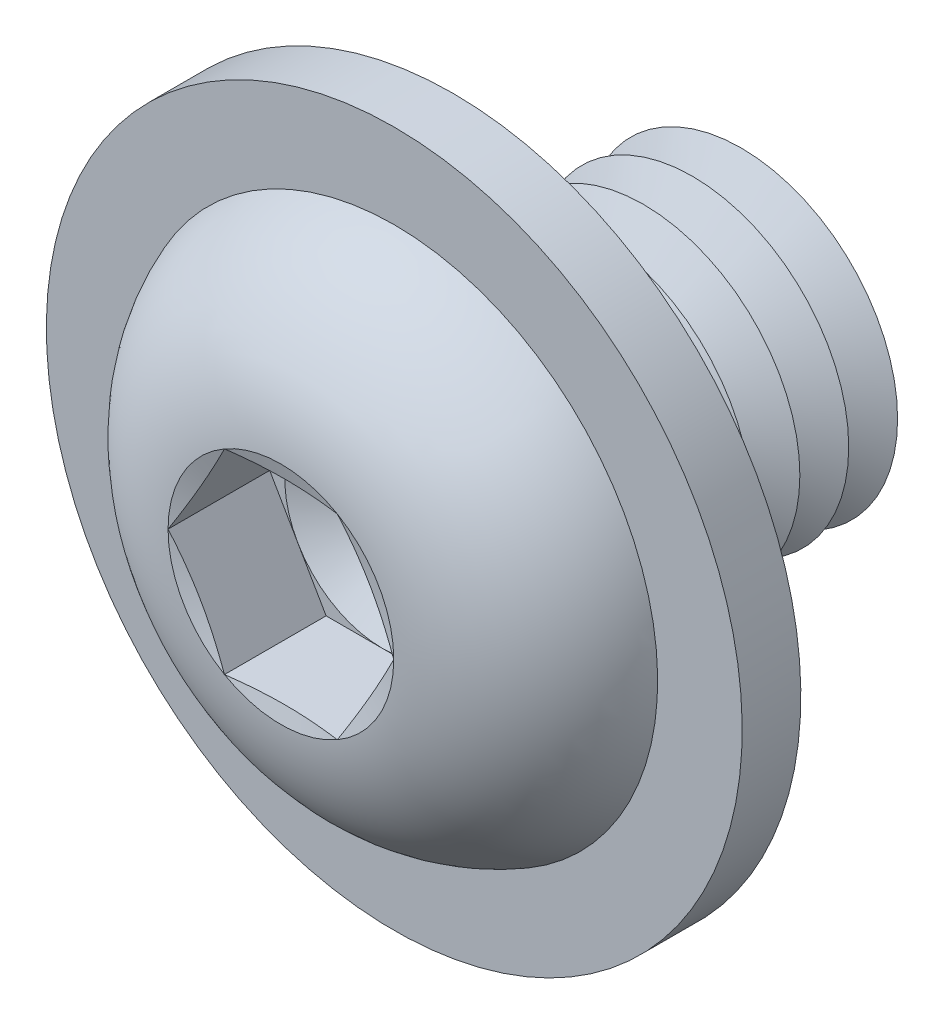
SolidWorks part; units mm, degrees
ref_plane "Front Plane" through (0, 0, 0) normal (0, 0, 1) x (1, 0, 0)
ref_plane "Top Plane" through (0, 0, 0) normal (0, 1, 0) x (1, 0, 0)
ref_plane "Right Plane" through (0, 0, 0) normal (1, 0, 0) x (0, 0, -1)
sketch "Sketch1" plane through (0, 0, 0) normal (1, 0, 0) x (0, 0, -1)
  line L0 (0, 4) -> (0, 7)
  line L3 (0, 4) -> (8, 4)
  line L4 (8, 4) -> (8, 0)
  line L5 (8, 0) -> (-4.4, 0) construction
  line L6 (-4.4, 0) -> (8, 0)
  line L7 (-4.4, 2.8867) -> (-4.4, 1.4434) construction
  line L8 (-4.4, 1.4434) -> (-4.4, 0)
  line L9 (-4.4, 2.8867) -> (-4.0132, 1.4434)
  line L10 (-4.0132, 1.4434) -> (-4.4, 1.4434)
  line L11 (8, 0) -> (22.7481, 0) construction
  line L12 (0, 7) -> (-4.4, 7) construction
  arc A1 (0, 7) -> (-4.4, 2.8867) centre (0, 2.59) ccw
  point P8 (8, 2)
  dimension "D1" = 14
  dimension "D2" = 8
  dimension "D3" = 4.4
  dimension "D4" = 5.7735
  dimension "D5" = 8
  dimension "D6" = 15
revolve "Revolve1" add sketch "Sketch1" angle 360 about L5
fillet "Fillet1" radius 0.625 1 edges at (0, 4, 0)
sketch "Sketch2" plane through (0, 0, 0) normal (1, 0, 0) x (0, 0, -1)
  line L0 (7.375, 4) -> (8.625, 4)
  line L1 (8, 4) -> (0.625, 4) construction
  line L2 (8.625, 4) -> (8, 2.9175)
  line L3 (8, -4) -> (8, 4) construction
  line L4 (8, 2.9175) -> (7.375, 4)
  dimension "D1" = 1.25
revolve "Cut-Revolve1" cut sketch "Sketch2" angle 360 about axis through (0, 0, -8) along (0, 0, -1)
pattern_linear "LPattern1" count 6 spacing 1.25 along (0, 0, 1) of "Cut-Revolve1"
sketch "Sketch3" plane through (0, 0, 4.4) normal (0, 0, 1) x (1, 0, 0)
  line L7 (1.4434, 2.5) -> (-1.4434, 2.5)
  line L8 (-1.4434, 2.5) -> (-2.8868, 0)
  line L9 (-2.8868, 0) -> (-1.4434, -2.5)
  line L10 (-1.4434, -2.5) -> (1.4434, -2.5)
  line L11 (1.4434, -2.5) -> (2.8868, 0)
  line L12 (2.8868, 0) -> (1.4434, 2.5)
  circle A0 centre (0, 0) radius 2.5 construction
  circle A3 centre (0, 0) radius 2.8868 construction
extrude "Cut-Extrude1" cut sketch "Sketch3" against normal blind 2.6
sketch "Sketch4" plane through (0, 0, 1.8) normal (0, 0, 1) x (1, 0, 0)
  line L1 (1.4434, 2.5) -> (-1.4434, 2.5) construction
  circle A0 centre (0, 0) radius 2.5
extrude "Cut-Extrude2" cut sketch "Sketch4" against normal through all draft 60
sketch "Sketch5" plane through (0, 0, 0) normal (0, 0, -1) x (-1, 0, 0)
  circle A0 centre (0, 0) radius 8.9
  circle A1 centre (0, 0) radius 4.625
  circle A2 centre (0, 0) radius 4.625 construction
  dimension "D1" = 17.8
extrude "Boss-Extrude1" add sketch "Sketch5" against normal blind 1.5
